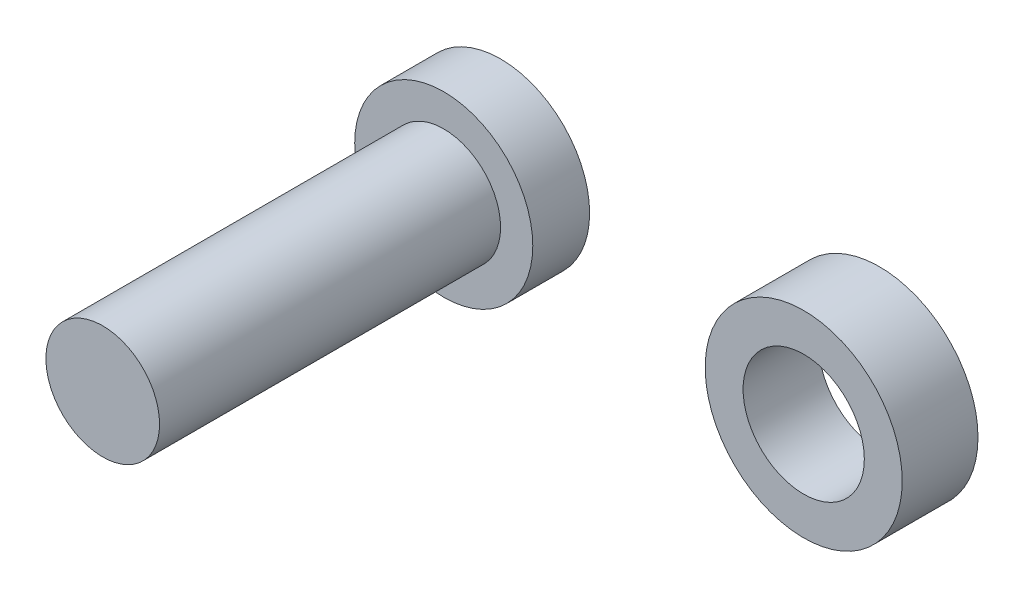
SolidWorks part; units mm, degrees
ref_plane "Ebene vorne" through (0, 0, 0) normal (0, 0, 1) x (1, 0, 0)
ref_plane "Ebene oben" through (0, 0, 0) normal (0, 1, 0) x (1, 0, 0)
ref_plane "Ebene rechts" through (0, 0, 0) normal (1, 0, 0) x (0, 0, -1)
sketch "Skizze1" plane through (0, 0, 0) normal (0, 0, 1) x (1, 0, 0)
  circle A0 centre (0, 0) radius 2.35
  dimension "D1" = 4.7
extrude "Aufsatz-Linear austragen1" add sketch "Skizze1" along normal blind 1.5
sketch "Skizze2" plane through (0, 0, 1.5) normal (0, 0, 1) x (1, 0, 0)
  circle A0 centre (0, 0) radius 1.5
  dimension "D1" = 3
extrude "Aufsatz-Linear austragen2" add sketch "Skizze2" along normal blind 9
sketch "Skizze3" plane through (0, 0, 0) normal (0, 0, 1) x (1, 0, 0)
  circle A1 centre (10, 0) radius 1.6
  circle A3 centre (10, 0) radius 2.6
  dimension "D1" = 3.2
  dimension "D3" = 1
  dimension "D2" = 10
extrude "Aufsatz-Linear austragen3" add sketch "Skizze3" along normal blind 2 separate body
